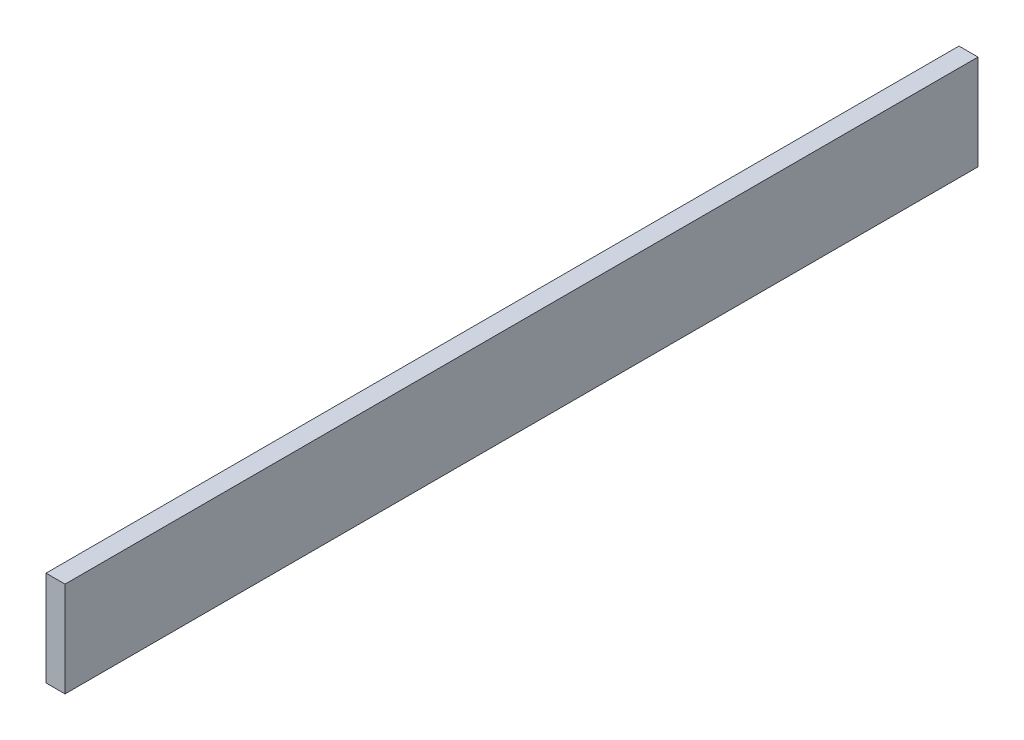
SolidWorks part; units mm, degrees
ref_plane "Ebene vorne" through (0, 0, 0) normal (0, 0, 1) x (1, 0, 0)
ref_plane "Ebene oben" through (0, 0, 0) normal (0, 1, 0) x (1, 0, 0)
ref_plane "Ebene rechts" through (0, 0, 0) normal (1, 0, 0) x (0, 0, -1)
sketch "Skizze1" plane through (0, 0, 0) normal (0, 0, 1) x (1, 0, 0)
  line L1 (0, 0) -> (10, 0)
  line L2 (0, 0) -> (0, 50)
  line L3 (0, 50) -> (10, 50)
  line L4 (10, 0) -> (10, 50)
  dimension "D1" = 50
  dimension "D2" = 10
extrude "Linear austragen1" add sketch "Skizze1" against normal blind 480
equation "\"LÄNGE\"=0"
equation "\"BREITE\"=0"
equation "\"HÖHE\"=0"
equation "\"DURCHMESSER\"=0"
equation "\"Stückzahl\"= 1"
